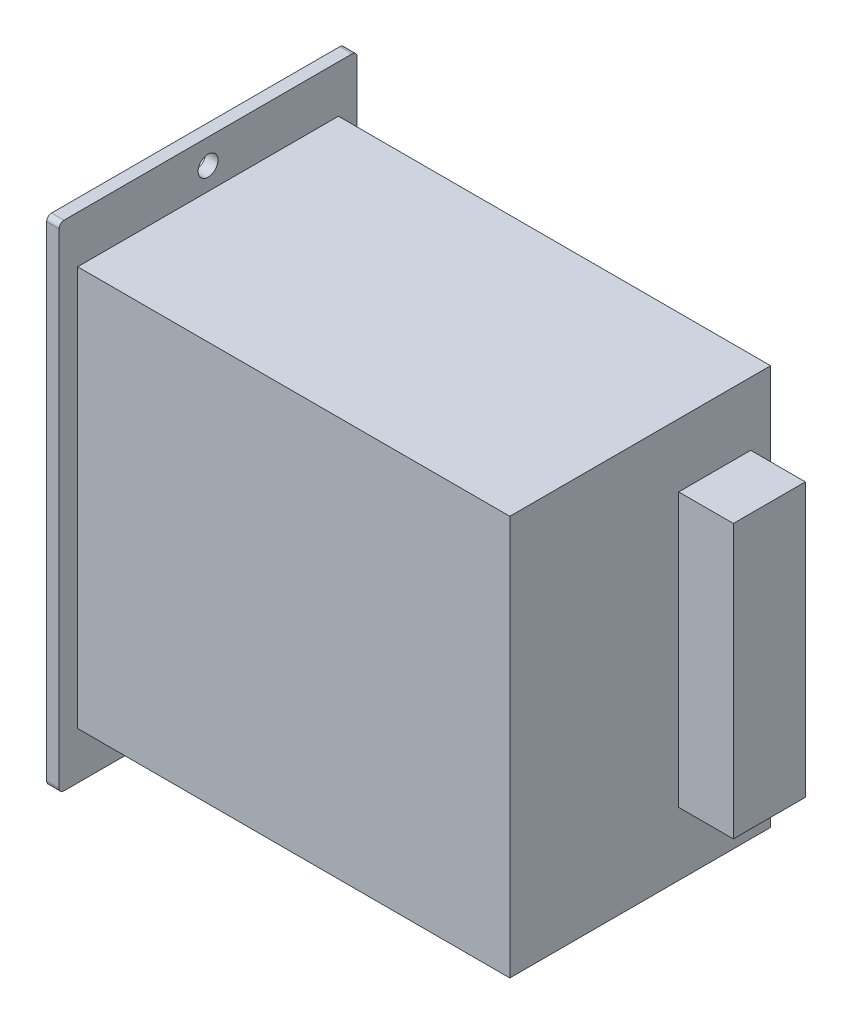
SolidWorks part; units mm, degrees
ref_plane "前视基准面" through (0, 0, 0) normal (0, 0, 1) x (1, 0, 0)
ref_plane "上视基准面" through (0, 0, 0) normal (0, 1, 0) x (1, 0, 0)
ref_plane "右视基准面" through (0, 0, 0) normal (1, 0, 0) x (0, 0, -1)
sketch "草图1" plane through (0, 0, 0) normal (1, 0, 0) x (0, 0, -1)
  line L1 (-30, -49.75) -> (30, -49.75)
  line L2 (-30, -49.75) -> (-30, 49.75)
  line L3 (-30, 49.75) -> (30, 49.75)
  line L4 (30, -49.75) -> (30, 49.75)
  line L5 (-30, -49.75) -> (30, 49.75) construction
  line L6 (-30, 49.75) -> (30, -49.75) construction
  point P0 (0, 0)
extrude "凸台-拉伸1" add sketch "草图1" along normal blind 2.5
sketch "草图2" plane through (2.5, 0, 0) normal (1, 0, 0) x (0, 0, -1)
  line L1 (-26.25, -40.25) -> (26.25, -40.25)
  line L2 (-26.25, -40.25) -> (-26.25, 40.25)
  line L3 (-26.25, 40.25) -> (26.25, 40.25)
  line L4 (26.25, -40.25) -> (26.25, 40.25)
  line L5 (-26.25, -40.25) -> (26.25, 40.25) construction
  line L6 (-26.25, 40.25) -> (26.25, -40.25) construction
  point P0 (0, 0)
extrude "凸台-拉伸2" add sketch "草图2" along normal blind 87
sketch "草图3" plane through (89.5, 0, 0) normal (1, 0, 0) x (0, 0, -1)
  line L3 (22.25, 27.5) -> (7.75, 27.5)
  line L4 (7.75, 27.5) -> (7.75, -27.5)
  line L5 (7.75, -27.5) -> (22.25, -27.5)
  line L6 (22.25, -27.5) -> (22.25, 27.5)
extrude "凸台-拉伸3" add sketch "草图3" along normal blind 11
sketch "草图4" plane through (0, 0, 0) normal (-1, 0, 0) x (0, 0, 1)
  line L1 (-28.75, -40.25) -> (28.75, -40.25)
  line L2 (-28.75, -40.25) -> (-28.75, 40.25)
  line L3 (-28.75, 40.25) -> (28.75, 40.25)
  line L4 (28.75, -40.25) -> (28.75, 40.25)
  line L5 (-28.75, -40.25) -> (28.75, 40.25) construction
  line L6 (-28.75, 40.25) -> (28.75, -40.25) construction
  point P0 (0, 0)
extrude "凸台-拉伸4" add sketch "草图4" along normal blind 1
chamfer "倒角1" distance 1 angle 45 4 edges at (-1, -40.25, 0) (-1, 0, -28.75) (-1, 40.25, 0) (-1, 0, 28.75)
fillet "圆角1" radius 1 4 edges at (1.25, -49.75, -30) (1.25, -49.75, 30) (1.25, 49.75, 30) (1.25, 49.75, -30)
sketch "草图5" plane through (0, 0, 0) normal (-1, 0, 0) x (0, 0, 1)
  circle A0 centre (0, 44.75) radius 2
  circle A1 centre (0, -44.75) radius 2.5
extrude "切除-拉伸1" cut sketch "草图5" against normal blind 3
